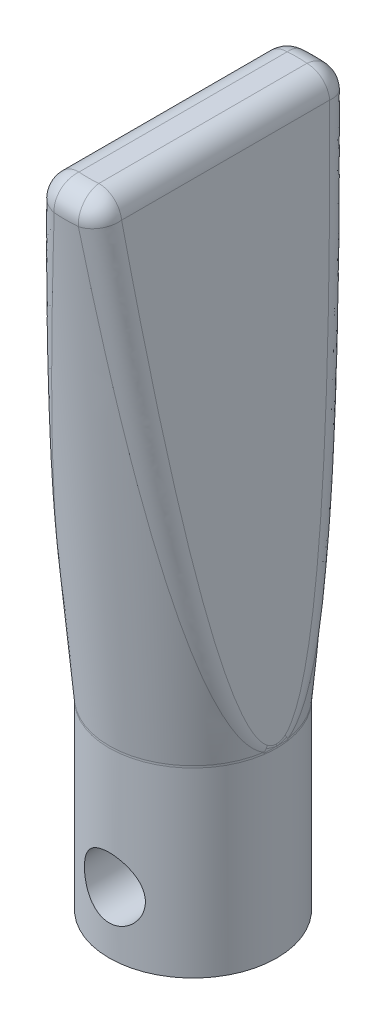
SolidWorks part; units mm, degrees
ref_plane "Plan1" through (0, 0, 0) normal (0, 0, 1) x (1, 0, 0)
ref_plane "Plan2" through (0, 0, 0) normal (0, 1, 0) x (1, 0, 0)
ref_plane "Plan3" through (0, 0, 0) normal (1, 0, 0) x (0, 0, -1)
sketch "Esquisse1" plane through (0, 0, 0) normal (1, 0, 0) x (0, 0, -1)
  line L0 (0, 22.9899) -> (0, -21.333) construction
  line L1 (0, -6) -> (2.75, -6)
  line L2 (2.75, -6) -> (2.75, 0)
  line L3 (2.75, 0) -> (4.25, 16.5)
  line L4 (4.25, 16.5) -> (0, 16.5)
  line L7 (0, 16.5) -> (0, -6)
  dimension "D1" = 8.5
  dimension "D2" = 5.5
  dimension "D3" = 6
  dimension "D4" = 16.5
revolve "Base-Révolution" add sketch "Esquisse1" angle 360 about L0
sketch "Esquisse2" plane through (0, 0, 0) normal (0, 0, 1) x (1, 0, 0)
  line L0 (1, 16.5) -> (2.75, 0)
  line L1 (2.75, 0) -> (4.25, 16.5)
  line L2 (4.25, 16.5) -> (1, 16.5)
  line L3 (4.25, 16.5) -> (-4.25, 16.5) construction
  line L4 (2.75, -6) -> (2.75, 0) construction
  line L5 (0, 2.492) -> (0, -7.1492) construction
  line L7 (2.75, 0) -> (4.25, 16.5) construction
  dimension "D1" = 2
extrude "Enlèv. mat.-Extru.1" cut sketch "Esquisse2" against normal through all and the other way through all
mirror "Symétrie1" about plane through (0, 0, 0) normal (1, 0, 0)
sketch "Esquisse3" plane through (0, 0, 0) normal (0, 0, 1) x (1, 0, 0)
  line L0 (0, 22.9899) -> (0, -21.333) construction
  circle A0 centre (0, -4) radius 1
  dimension "D1" = 4
  dimension "D2" = 2
extrude "Enlèv. mat.-Extru.2" cut sketch "Esquisse3" against normal through all and the other way through all
fillet "Congé1" radius 0.75
